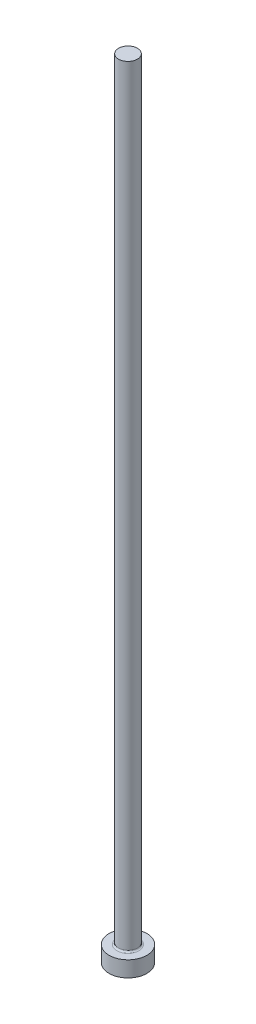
SolidWorks part; units mm, degrees
ref_plane "Plano frontal" through (0, 0, 0) normal (0, 0, 1) x (1, 0, 0)
ref_plane "Plano superior" through (0, 0, 0) normal (0, 1, 0) x (1, 0, 0)
ref_plane "Plano direito" through (0, 0, 0) normal (1, 0, 0) x (0, 0, -1)
sketch "Esboço1" plane through (0, 0, 0) normal (0, 0, 1) x (1, 0, 0)
  line L0 (0, 0) -> (6, 0)
  line L1 (6, 0) -> (6, 5)
  line L2 (6, 5) -> (3.5, 5)
  line L3 (3, 5.5) -> (3, 250)
  line L4 (3, 250) -> (0, 250)
  line L5 (0, 250) -> (0, 0) construction
  line L6 (0, 0) -> (0, 250)
  arc A0 (3.5, 5) -> (3, 5.5) centre (3.5, 5.5) cw
  dimension "D3" = 0.5
  dimension "D1" = 12
  dimension "D2" = 6
  dimension "D4" = 5
  dimension "D5" = 250
revolve "Revolução1" add sketch "Esboço1" angle 360 about L5
sketch "Esboço2"
  dimension "D1" = 3.225
  dimension "D2" = 1.05
  dimension "D3" = 0.675
  dimension "D4" = 0.45
wrap "Envolver1" sketch "Esboço2" wrap type deboss source sketch "Esboço2" thickness 0.1 parameters "D1"=0.1
